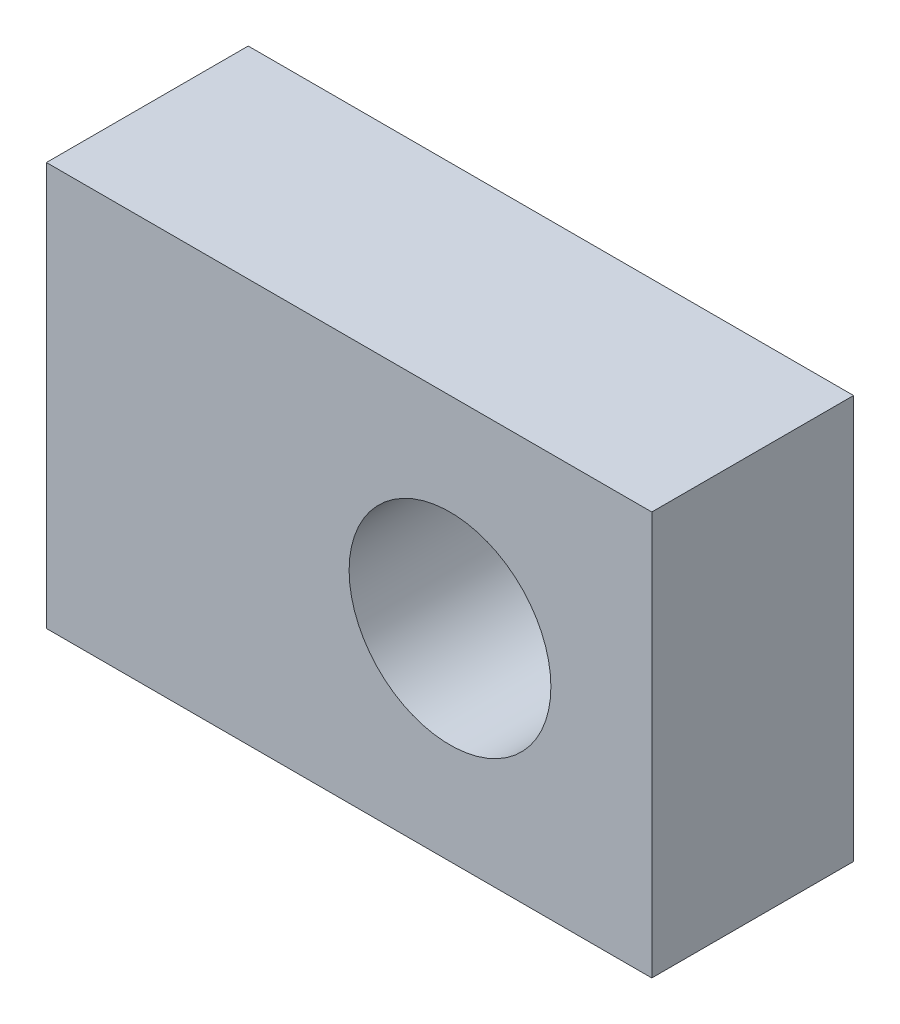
SolidWorks part; units mm, degrees
ref_plane "Front Plane" through (0, 0, 0) normal (0, 0, 1) x (1, 0, 0)
ref_plane "Top Plane" through (0, 0, 0) normal (0, 1, 0) x (1, 0, 0)
ref_plane "Right Plane" through (0, 0, 0) normal (1, 0, 0) x (0, 0, -1)
sketch "Sketch1" plane through (0, 0, 0) normal (0, 0, 1) x (1, 0, 0)
  line L1 (10.8657, 17.1906) -> (48.9657, 17.1906)
  line L2 (10.8657, 17.1906) -> (10.8657, -8.2094)
  line L3 (10.8657, -8.2094) -> (48.9657, -8.2094)
  line L4 (48.9657, 17.1906) -> (48.9657, -8.2094)
  circle A0 centre (36.2657, 4.4906) radius 6.35
  dimension "D3" = 12.7
  dimension "D4" = 12.7
  dimension "D5" = 12.7
  dimension "D1" = 25.4
  dimension "D2" = 38.1
extrude "Extrude1" add sketch "Sketch1" along normal blind 12.7
